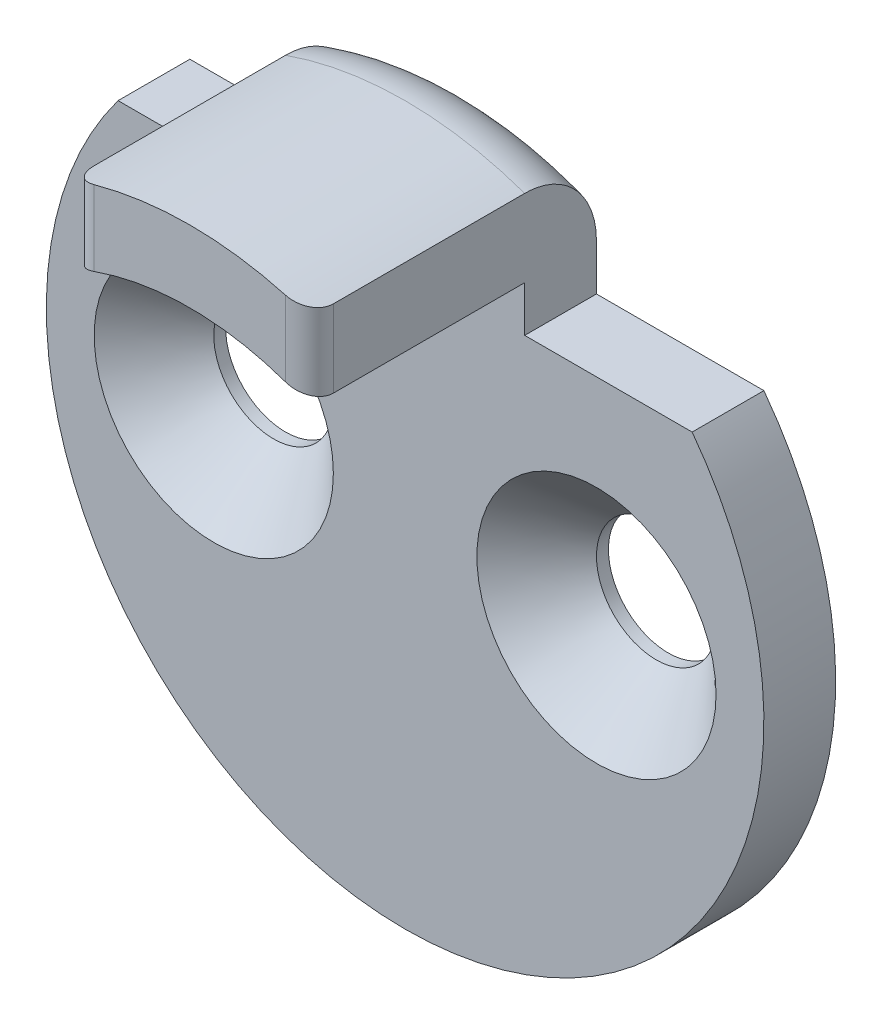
SolidWorks part; units mm, degrees
ref_plane "Plan de face" through (0, 0, 0) normal (0, 0, 1) x (1, 0, 0)
ref_plane "Plan de dessus" through (0, 0, 0) normal (0, 1, 0) x (1, 0, 0)
ref_plane "Plan de droite" through (0, 0, 0) normal (1, 0, 0) x (0, 0, -1)
sketch "Esquisse1" plane through (0, 0, 0) normal (0, 0, 1) x (1, 0, 0)
  line L0 (0, 0) -> (0, 15.2687) construction
  line L1 (-2.5, 4.5) -> (-6, 4.5)
  line L2 (-2.5, 4.5) -> (-2.5, 7.0711)
  line L3 (0, 0) -> (4, 0) construction
  line L5 (2.5, 4.5) -> (6, 4.5)
  line L6 (2.5, 4.5) -> (2.5, 7.0711)
  arc A0 (-6, 4.5) -> (6, 4.5) centre (0, 0) ccw
  arc A1 (2.5, 7.0711) -> (-2.5, 7.0711) centre (0, 0) ccw
  circle A2 centre (-4, 0) radius 1.25
  circle A3 centre (4, 0) radius 1.25
  point P1 (0, 7.5)
  dimension "D1" = 15
  dimension "D3" = 3
  dimension "D5" = 2.5
  dimension "D2" = 5
  dimension "D4" = 8
extrude "Boss.-Extru.1" add sketch "Esquisse1" along normal blind 1.5
sketch "Esquisse2" plane through (0, 0, 1.5) normal (0, 0, 1) x (1, 0, 0)
  line L1 (-2.5, 7.0711) -> (-2.5, 4.5) construction
  line L2 (2.5, 4.5) -> (2.5, 7.0711) construction
  line L3 (-2.5, 7.0711) -> (-2.5, 5.4544)
  line L4 (2.5, 5.4544) -> (2.5, 7.0711)
  arc A0 (2.5, 7.0711) -> (-2.5, 7.0711) centre (0, 0) ccw construction
  arc A1 (2.5, 7.0711) -> (-2.5, 7.0711) centre (0, 0) ccw
  arc A2 (2.5, 5.4544) -> (-2.5, 5.4544) centre (0, 0) ccw
  dimension "D1" = 1.5
extrude "Boss.-Extru.2" add sketch "Esquisse2" along normal blind 4.5
fillet "Congé1" radius 1.5 1 edges at (0, 7.5, 0)
fillet "Congé2" radius 0.5 2 edges at (2.5, 6.2627, 6) (-2.5, 6.2627, 6)
chamfer "Chanfrein1" distance 1.25 angle 45 2 edges at (-2.75, 0, 1.5) (5.25, 0, 1.5)
